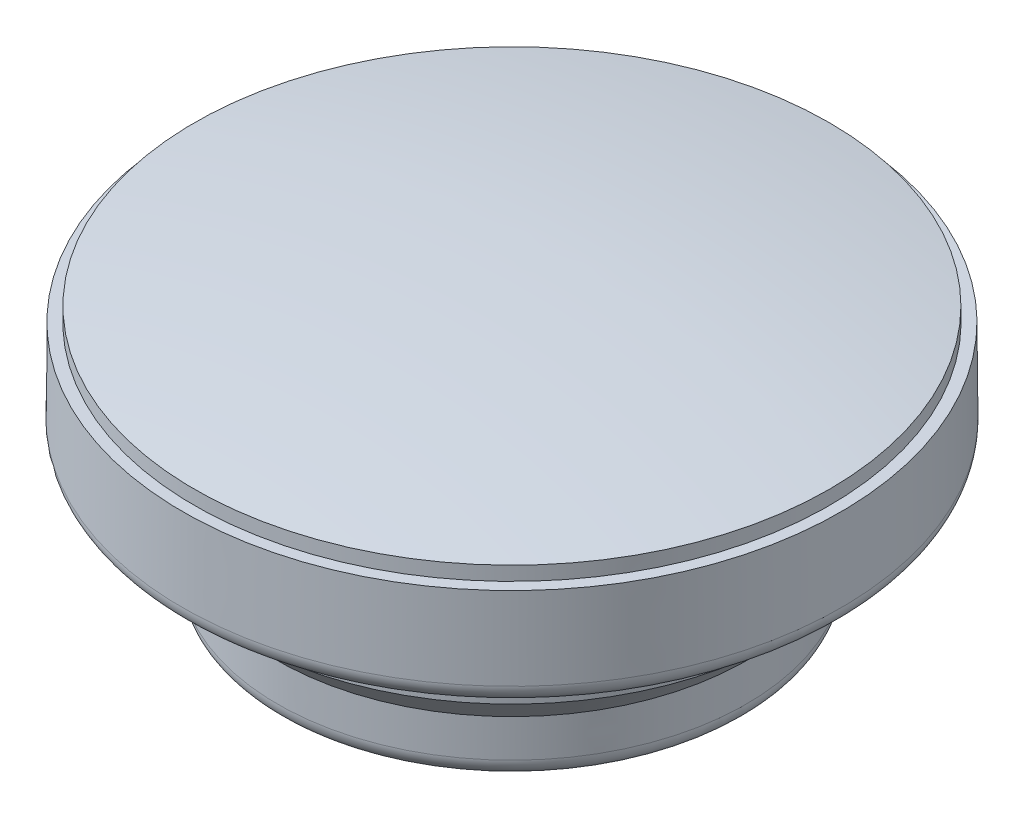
SolidWorks part; units mm, degrees
ref_plane "X" through (0, 0, 0) normal (0, 0, 1) x (1, 0, 0)
ref_plane "Y" through (0, 0, 0) normal (0, 1, 0) x (1, 0, 0)
ref_plane "Z" through (0, 0, 0) normal (1, 0, 0) x (0, 0, -1)
sketch "Esquisse1" plane through (0, 0, 0) normal (0, 0, 1) x (1, 0, 0)
  line L0 (0, 0) -> (0, 30.2497) construction
  line L1 (8.7764, -1.0956) -> (8.7956, -3.2956)
  line L2 (8.2956, -3.8) -> (7.7849, -3.8)
  line L3 (6.2632, -5.7868) -> (7.25, -4.8)
  line L4 (6.2632, -5.7868) -> (6.25, -7.2956)
  line L5 (6.25, -7.2956) -> (4.25, -7.2956)
  line L6 (4.25, -7.2956) -> (4.1783, -3.1861)
  line L7 (0, 0) -> (0, -10.8031) construction
  line L8 (0, 0) -> (0, -3)
  line L9 (7.7728, -3) -> (7.7728, -4.9657) construction
  line L10 (7.7762, -3.3) -> (7.7849, -3.8)
  line L11 (7.7762, -3.3) -> (7.2762, -3.3)
  line L12 (7.2762, -3.3) -> (7.25, -4.8)
  line L13 (8.7956, -3.2956) -> (14.14, -3.2956) construction
  line L14 (8.7764, -1.0956) -> (8.4764, -1.0956)
  line L15 (8.4764, -1.0956) -> (8.4731, -0.7232)
  arc A0 (8.4731, -0.7232) -> (0, 0) centre (0, -50) ccw
  arc A1 (4.1783, -3.1861) -> (0, -3) centre (0, -50) ccw
  arc A2 (8.7956, -3.2956) -> (8.2956, -3.8) centre (8.2956, -3.3) cw
  point P20 (8.8, -3.8)
  dimension "D1" = 50
  dimension "D15" = 0.5
  dimension "D2" = 17.6
  dimension "D3" = 1
  dimension "D4" = 2
  dimension "D6" = 0.5
  dimension "D7" = 0.5
  dimension "D8" = 0.5
  dimension "D9" = 1
  dimension "D10" = 14.5
  dimension "D11" = 0.5
  dimension "D12" = 12.5
  dimension "D13" = 1
  dimension "D14" = 45
  dimension "D16" = 2.2
  dimension "D17" = 1
  dimension "D18" = 4
  dimension "D19" = 0.3
  dimension "D20" = 0.5
  dimension "D21" = 3.8
  dimension "D5" = 3
revolve "Base-Révolution" add sketch "Esquisse1" angle 360 about L0
fillet "Congé1" radius 0.5
